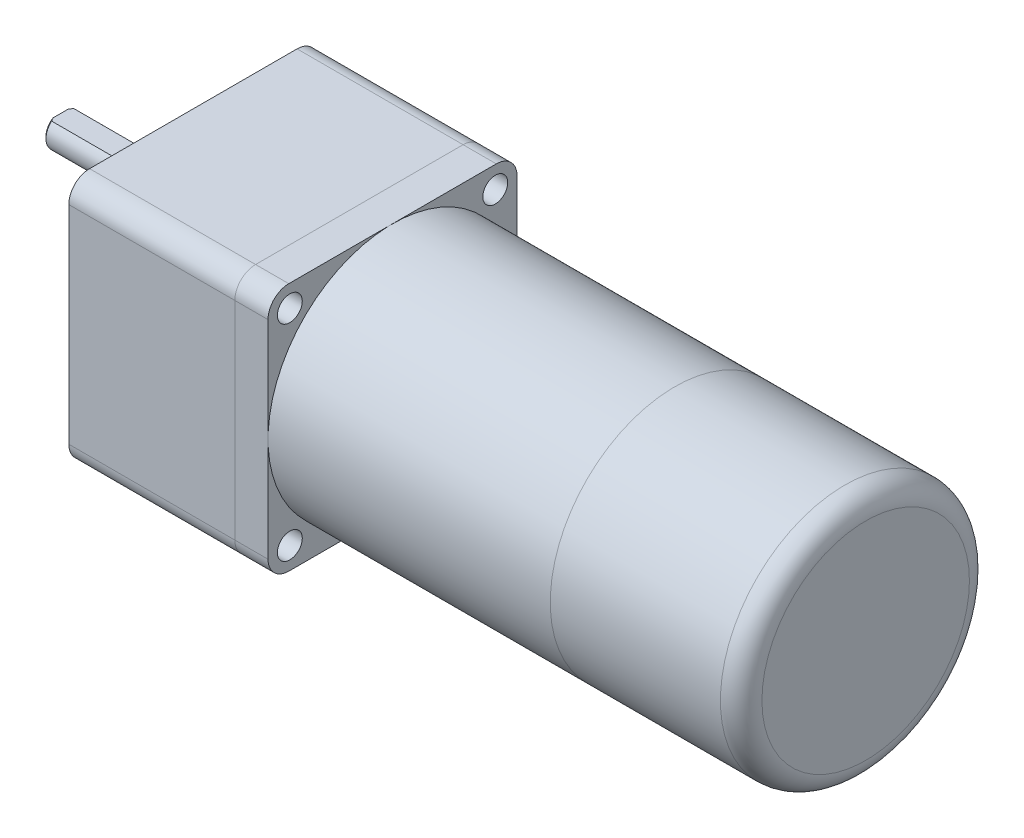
SolidWorks part; units mm, degrees
ref_plane "前视基准面" through (0, 0, 0) normal (0, 0, 1) x (1, 0, 0)
ref_plane "上视基准面" through (0, 0, 0) normal (0, 1, 0) x (1, 0, 0)
ref_plane "右视基准面" through (0, 0, 0) normal (1, 0, 0) x (0, 0, -1)
sketch "草图1" plane through (0, 0, 0) normal (1, 0, 0) x (0, 0, -1)
  line L1 (-25, -30) -> (25, -30)
  line L2 (-30, -25) -> (-30, 25)
  line L3 (-25, 30) -> (25, 30)
  line L4 (30, -25) -> (30, 25)
  line L5 (-30, -30) -> (30, 30) construction
  line L6 (-30, 30) -> (30, -30) construction
  arc A0 (-25, -30) -> (-30, -25) centre (-25, -25) cw
  arc A1 (-30, 25) -> (-25, 30) centre (-25, 25) cw
  arc A2 (25, 30) -> (30, 25) centre (25, 25) cw
  arc A3 (25, -30) -> (30, -25) centre (25, -25) ccw
  point P0 (0, 0)
  dimension "D1" = 5
extrude "凸台-拉伸1" add sketch "草图1" along normal blind 40
sketch "草图2" plane through (40, 0, 0) normal (1, 0, 0) x (0, 0, -1)
  line L0 (25, 30) -> (-25, 30) construction
  line L1 (-25, -30) -> (25, -30)
  line L2 (-30, -25) -> (-30, 25)
  line L3 (-25, 30) -> (25, 30)
  line L4 (30, -25) -> (30, 25)
  line L5 (-30, -30) -> (30, 30) construction
  line L6 (-30, 30) -> (30, -30) construction
  arc A0 (-25, -30) -> (-30, -25) centre (-25, -25) cw
  arc A1 (25, -30) -> (30, -25) centre (25, -25) ccw
  arc A2 (25, 30) -> (30, 25) centre (25, 25) cw
  arc A3 (-30, 25) -> (-25, 30) centre (-25, 25) cw
  point P0 (0, 0)
  dimension "D1" = 5
extrude "凸台-拉伸2" add sketch "草图2" along normal blind 8 separate body
sketch "草图3" plane through (48, 0, 0) normal (1, 0, 0) x (0, 0, -1)
  circle A0 centre (0, 0) radius 30
extrude "凸台-拉伸3" add sketch "草图3" along normal blind 68 separate body
sketch "草图4" plane through (116, 0, 0) normal (1, 0, 0) x (0, 0, -1)
  circle A0 centre (0, 0) radius 30
extrude "凸台-拉伸4" add sketch "草图4" along normal blind 46 separate body
fillet "圆角1" radius 5 1 edges at (162, 0, -30)
sketch "草图5" plane through (0, 0, 0) normal (-1, 0, 0) x (0, 0, 1)
  point P19 (-24.7487, 24.7487)
  point P20 (24.7487, 24.7487)
  point P21 (24.7487, -24.7487)
  point P22 (-24.7487, -24.7487)
hole_wizard "M4 螺纹孔1" positions "3D草图1" profile "草图6" tap size "M4" standard "GB"
sketch3d "3D草图1"
  point P0 (0, 24.7487, -24.7487)
  point P3 (0, 24.7487, 24.7487)
  point P6 (0, -24.7487, 24.7487)
  point P9 (0, -24.7487, -24.7487)
sketch "草图6" plane through (0, 24.7487, -24.7487) normal (0, 1, 0) x (0, 0, 1)
  line L0 (0, 0) -> (0, 12.4914)
  line L1 (0, 12.4914) -> (1.65, 11.5)
  line L2 (1.65, 11.5) -> (1.65, 0)
  line L5 (1.65, 0) -> (0, 0)
  line L10 (0, 12.4914) -> (-1.65, 11.5) construction
  line L11 (0, -6.35) -> (0, 107.95) construction
  dimension "螺纹孔钻头直径" = 3.3
  dimension "螺纹孔钻头深度" = 11.5
  dimension "导头角度" = 118
sketch "草图7" plane through (48, 0, 0) normal (1, 0, 0) x (0, 0, -1)
  circle A1 centre (-24.7487, 24.7487) radius 3
  circle A2 centre (24.7487, 24.7487) radius 3
  circle A3 centre (24.7487, -24.7487) radius 3
  circle A4 centre (-24.7487, -24.7487) radius 3
extrude "切除-拉伸1" cut sketch "草图7" against normal blind 36.5
fillet "圆角2" radius 0.5 4 edges at (0, -24.7487, -23.0987) (0, -24.7487, 26.3987) (0, 24.7487, 26.3987) (0, 24.7487, -23.0987)
sketch "草图8" plane through (0, 0, 0) normal (-1, 0, 0) x (0, 0, 1)
  circle A0 centre (0, 10) radius 12
extrude "凸台-拉伸5" add sketch "草图8" along normal blind 3.3 separate body
fillet "圆角3" radius 0.5 1 edges at (-3.3, 10, 12)
sketch "草图9" plane through (-3.3, 0, 0) normal (-1, 0, 0) x (0, 0, 1)
  circle A0 centre (0, 10) radius 4
extrude "凸台-拉伸6" add sketch "草图9" along normal blind 28.7 separate body
sketch "草图10" plane through (-32, 0, 0) normal (-1, 0, 0) x (0, 0, 1)
  line L2 (2.6458, 13) -> (-2.6458, 13)
  circle A0 centre (0, 10) radius 4 construction
  arc A1 (2.6458, 13) -> (-2.6458, 13) centre (0, 10) ccw
extrude "切除-拉伸2" cut sketch "草图10" against normal blind 25
chamfer "倒角1" distance 0.5 angle 45 1 edges at (-32, 6, 0)
sketch "草图11" plane through (0, 0, 0) normal (-1, 0, 0) x (0, 0, 1)
  circle A0 centre (0, 0) radius 26.3
extrude "切除-拉伸3" cut sketch "草图11" against normal blind 0.5
fillet "圆角4" radius 0.5 1 edges at (0, 0, 26.3)
